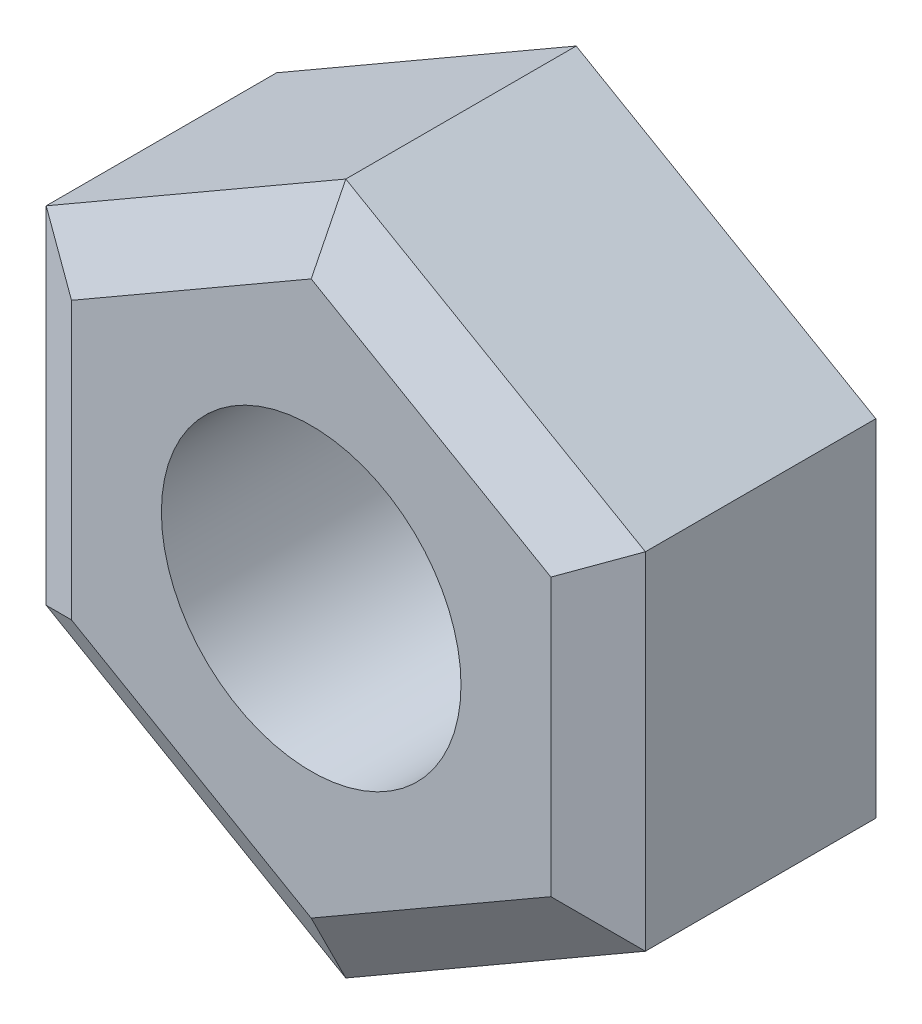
SolidWorks part; units mm, degrees
ref_plane "Plan de face" through (0, 0, 0) normal (0, 0, 1) x (1, 0, 0)
ref_plane "Plan de dessus" through (0, 0, 0) normal (0, 1, 0) x (1, 0, 0)
ref_plane "Plan de droite" through (0, 0, 0) normal (1, 0, 0) x (0, 0, -1)
sketch "Esquisse1" plane through (0, 0, 0) normal (0, 0, 1) x (1, 0, 0)
  line L1 (5, -2.8868) -> (5, 2.8868)
  line L2 (5, 2.8868) -> (0, 5.7735)
  line L3 (0, 5.7735) -> (-5, 2.8868)
  line L4 (-5, 2.8868) -> (-5, -2.8868)
  line L5 (-5, -2.8868) -> (0, -5.7735)
  line L6 (0, -5.7735) -> (5, -2.8868)
  circle A0 centre (0, 0) radius 5 construction
  dimension "D1" = 10
extrude "Boss.-Extru.1" add sketch "Esquisse1" along normal blind 5
hole_wizard "Trou taraudé M6x1.01" positions "Esquisse3" profile "Esquisse2" tap size "M6x1.0" standard "Ansi Metric"
sketch "Esquisse3" plane through (0, 0, 5) normal (0, 0, 1) x (1, 0, 0)
  point P0 (0, 0)
sketch "Esquisse2" plane through (0, 0, 5) normal (1, 0, 0) x (0, -1, 0)
  line L0 (0, 0) -> (0, 5)
  line L1 (0, 5) -> (2.5, 5)
  line L2 (2.5, 5) -> (2.5, 0)
  line L5 (2.5, 0) -> (0, 0)
  line L11 (0, -6.35) -> (0, 107.95) construction
  dimension "Diamètre du trou pour taraudage jusqu'au prochain" = 5
  dimension "Profondeur du trou pour taraudage jusqu'au prochain" = 5
chamfer "Chanfrein1" distance 1 angle 30 6 edges at (5, 0, 5) (2.5, -4.3301, 5) (-2.5, -4.3301, 5) (-5, 0, 5) (-2.5, 4.3301, 5) (2.5, 4.3301, 5)
chamfer "Chanfrein2" distance 1 angle 30 6 edges at (2.5, -4.3301, 0) (-2.5, -4.3301, 0) (-5, 0, 0) (-2.5, 4.3301, 0) (2.5, 4.3301, 0) (5, 0, 0)
